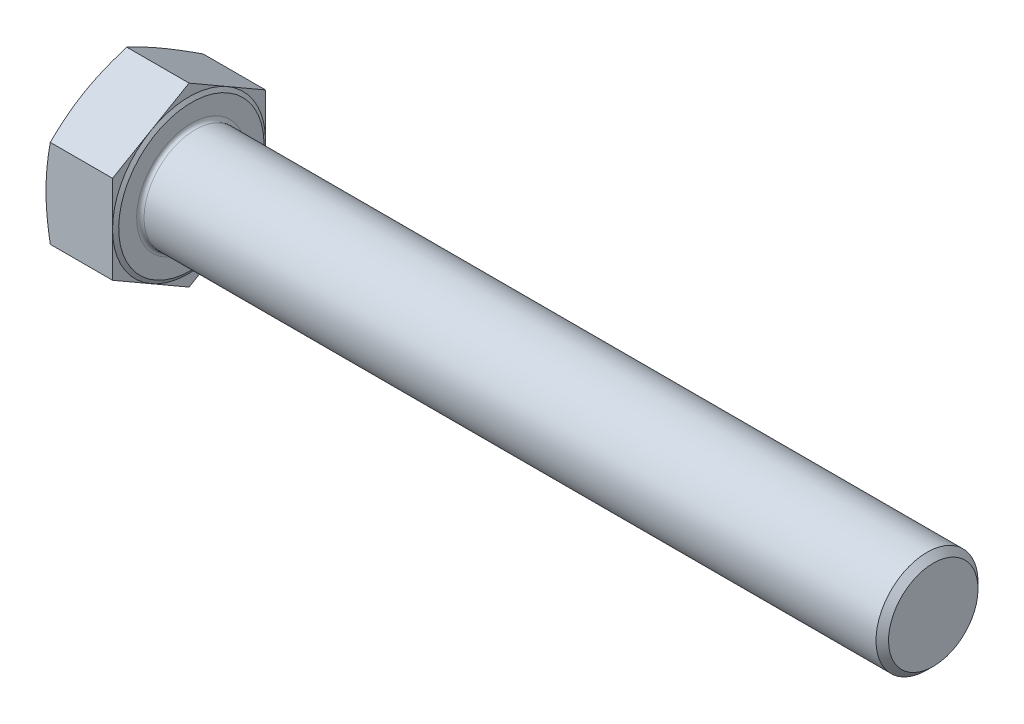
SolidWorks part; units mm, degrees
ref_plane "Front" through (0, 0, 0) normal (0, 0, 1) x (1, 0, 0)
ref_plane "Top" through (0, 0, 0) normal (0, 1, 0) x (1, 0, 0)
ref_plane "Right" through (0, 0, 0) normal (1, 0, 0) x (0, 0, -1)
sketch "Sketch-BaseHead" plane through (0, 0, 0) normal (1, 0, 0) x (0, 0, -1)
  line L1 (0, -19.0526) -> (16.5, -9.5263)
  line L2 (16.5, -9.5263) -> (16.5, 9.5263)
  line L3 (16.5, 9.5263) -> (0, 19.0526)
  line L4 (0, 19.0526) -> (-16.5, 9.5263)
  line L5 (-16.5, 9.5263) -> (-16.5, -9.5263)
  line L6 (-16.5, -9.5263) -> (0, -19.0526)
  circle A0 centre (0, 0) radius 16.5 construction
  dimension "s" = 33
extrude "BaseHead" add sketch "Sketch-BaseHead" along normal blind 14.35
sketch "Sketch4" plane through (-0.2646, -5.9169, 0) normal (0, 0, 1) x (0, 1, 0)
  line L0 (5.9169, 3.7369) -> (5.9169, -10.4477) construction
  line L2 (24.9695, -0.2646) -> (22.4169, -0.2646)
  line L4 (22.4169, -0.2646) -> (24.9695, -1.1937)
  line L6 (24.9695, -1.1937) -> (24.9695, -0.2646)
  dimension "D1" = 20
  dimension "D2" = 33
revolve "HeadChamfer" cut sketch "Sketch4" angle 360 about L0
sketch "Sketch1" plane through (0, 0, 0) normal (0, 1, 0) x (1, 0, 0)
  line L0 (14.35, 0) -> (14.85, 0)
  line L1 (14.85, 0) -> (14.85, 15.675)
  line L2 (14.85, 15.675) -> (14.35, 16.5)
  line L3 (14.35, 16.5) -> (14.35, 0)
  line L4 (-4.0016, 0) -> (10.1831, 0) construction
  dimension "D1" = 16.5
  dimension "D2" = 15.675
  dimension "D3" = 0.5
revolve "Revolve1" add sketch "Sketch1" angle 360 about axis through (-4.0016, 0, 0) along (1, 0, 0)
sketch "Sketch3" plane through (14.85, 0, 0) normal (1, 0, 0) x (0, 0, -1)
  circle A0 centre (0, 0) radius 11
  dimension "d" = 22
extrude "BaseBody" add sketch "Sketch3" along normal blind 160
chamfer "Chamfer1" distance 1.353 angle 45 1 edges at (174.85, 11, 0)
fillet "HeadFillet" radius 0.8 1 edges at (14.85, -11, 0)
equation "\"D1@Sketch1\" = \"s@Sketch-BaseHead\" / 2 "
equation "\"D2@Sketch4\" = \"s@Sketch-BaseHead\""
equation "\"D1@Chamfer1\" =  ( \"d@Sketch3\" - \"D2@ThreadCosmetic1\" ) / 2 "
